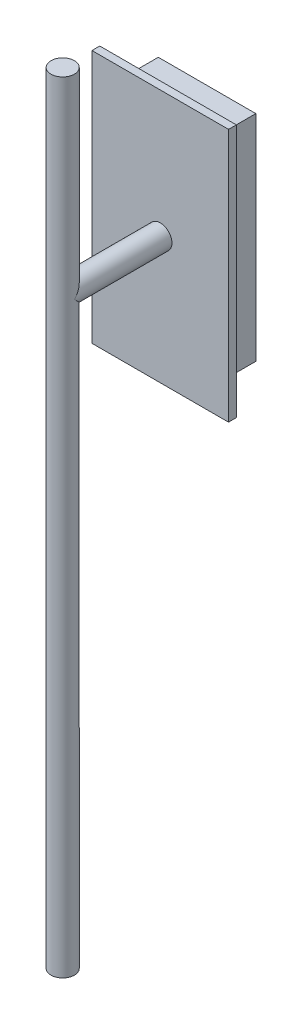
SolidWorks part; units mm, degrees
ref_plane "Alzado" through (0, 0, 0) normal (0, 0, 1) x (1, 0, 0)
ref_plane "Planta" through (0, 0, 0) normal (0, 1, 0) x (1, 0, 0)
ref_plane "Vista lateral" through (0, 0, 0) normal (1, 0, 0) x (0, 0, -1)
sketch "Croquis1" plane through (0, 0, 0) normal (0, 0, 1) x (1, 0, 0)
  line L1 (-35, -65) -> (35, -65)
  line L2 (-35, -65) -> (-35, 65)
  line L3 (-35, 65) -> (35, 65)
  line L4 (35, -65) -> (35, 65)
  line L5 (-35, -65) -> (35, 65) construction
  line L6 (-35, 65) -> (35, -65) construction
  point P0 (0, 0)
  dimension "D1" = 70
  dimension "D2" = 130
extrude "Saliente-Extruir1" add sketch "Croquis1" along normal blind 4
sketch "Croquis2" plane through (0, 0, 0) normal (0, 0, -1) x (-1, 0, 0)
  line L8 (-25, 55) -> (-25, -55)
  line L9 (-25, -55) -> (25, -55)
  line L10 (25, -55) -> (25, 55)
  line L11 (25, 55) -> (-25, 55)
  line L12 (-25, 55) -> (-25, -55)
  line L13 (-25, -55) -> (25, -55)
  line L14 (25, -55) -> (25, 55)
  line L15 (25, 55) -> (-25, 55)
  dimension "D1" = 10
extrude "Saliente-Extruir2" add sketch "Croquis2" along normal blind 20
sketch "Croquis3" plane through (0, 0, 4) normal (0, 0, 1) x (1, 0, 0)
  circle A0 centre (0, 0) radius 6
  dimension "D1" = 12
extrude "Saliente-Extruir3" add sketch "Croquis3" along normal blind 50
sketch "Croquis4" plane through (0, 0, 0) normal (0, 1, 0) x (1, 0, 0)
  line L0 (-6, -54) -> (6, -54) construction
  circle A0 centre (0, -54) radius 6
extrude "Saliente-Extruir4" add sketch "Croquis4" along normal blind 100 and the other way blind 300
